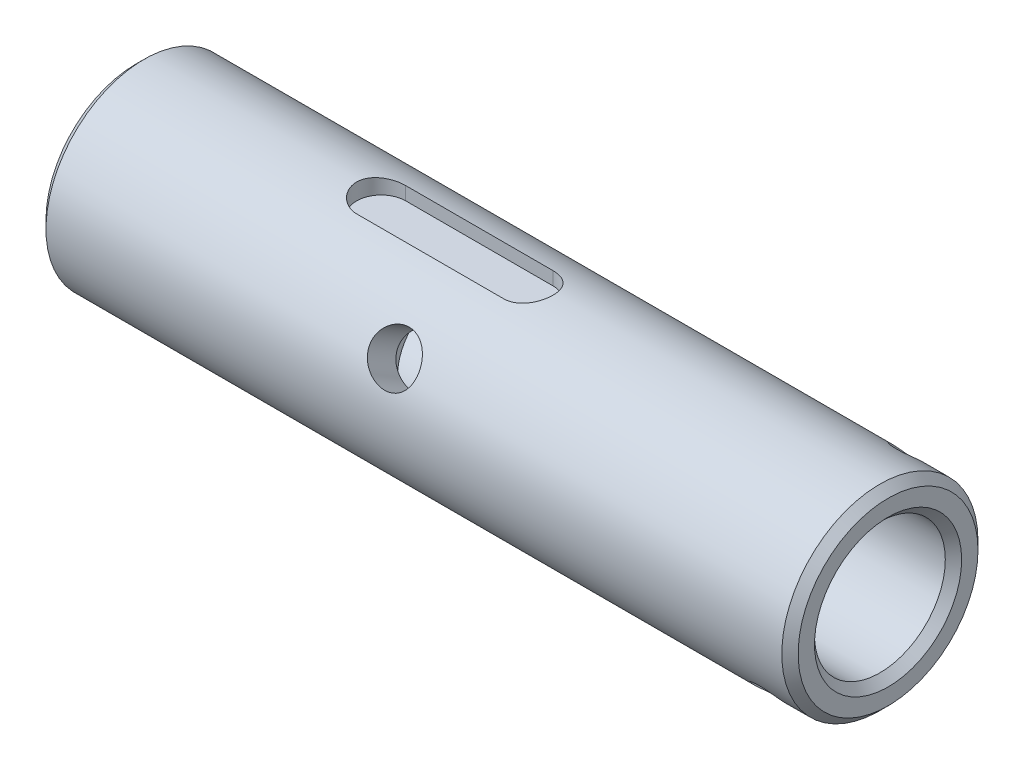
SolidWorks part; units mm, degrees
ref_plane "前视基准面" through (0, 0, 0) normal (0, 0, 1) x (1, 0, 0)
ref_plane "上视基准面" through (0, 0, 0) normal (0, 1, 0) x (1, 0, 0)
ref_plane "右视基准面" through (0, 0, 0) normal (1, 0, 0) x (0, 0, -1)
sketch "草图1" plane through (0, 0, 0) normal (1, 0, 0) x (0, 0, -1)
  circle A0 centre (0, 0) radius 12
  circle A1 centre (0, 0) radius 6
extrude "拉伸1" add sketch "草图1" along normal blind 92
sketch "草图2" plane through (0, 0, 0) normal (0, 1, 0) x (1, 0, 0)
  line L0 (0, 0) -> (40.9917, 0) construction
  line L1 (0, 3) -> (12, 3)
  line L2 (0, 12) -> (0, -12) construction
  line L3 (12, -3) -> (0, -3)
  line L4 (0, -3) -> (0, 3)
  arc A0 (12, 3) -> (12, -3) centre (12, 0) cw
extrude "切除-拉伸1" cut sketch "草图2" against normal through all
ref_plane "基准面1" through (0, 12, 0) normal (0, 1, 0) x (-1, 0, 0)
sketch "草图3" plane through (0, 12, 0) normal (0, 1, 0) x (-1, 0, 0)
  line L0 (-48, 3) -> (-30, 3)
  line L1 (-30, -3) -> (-48, -3)
  line L2 (0, 0) -> (-99.7989, 0) construction
  line L3 (0, -12) -> (0, 12) construction
  arc A0 (-30, 3) -> (-30, -3) centre (-30, 0) cw
  arc A1 (-48, -3) -> (-48, 3) centre (-48, 0) cw
  dimension "D3" = 3
  dimension "D1" = 30
  dimension "D2" = 18
extrude "切除-拉伸2" cut sketch "草图3" against normal blind 2
ref_plane "基准面2" through (0, -12, 0) normal (0, 1, 0) x (-1, 0, 0)
sketch "草图4" plane through (0, -12, 0) normal (0, 1, 0) x (-1, 0, 0)
  line L0 (0, -12) -> (0, 12) construction
  circle A0 centre (-42, 0) radius 3
  dimension "D1" = 42
extrude "切除-拉伸3" cut sketch "草图4" along normal up to next
ref_plane "基准面3" through (42, 0, 0) normal (-1, 0, 0) x (0, 0, 1)
sketch "草图5" plane through (42, 0, 0) normal (-1, 0, 0) x (0, 0, 1)
  line L0 (0, 0) -> (16.0641, 9.2746) construction
  line L1 (0, 0) -> (0, -13.8188) construction
  line L2 (4.128, 2.3833) -> (5.628, -0.2148)
  line L3 (5.628, -0.2148) -> (12.8001, 3.926)
  line L4 (12.8001, 3.926) -> (11.3001, 6.5241)
  line L5 (11.3001, 6.5241) -> (4.128, 2.3833)
  dimension "D1" = 120
revolve "切除-旋转1" cut sketch "草图5" angle 360 about L5
sketch "草图6" plane through (42, 0, 0) normal (-1, 0, 0) x (0, 0, 1)
  line L0 (0, 0) -> (0, -14.2482) construction
  line L1 (0, -14.2482) -> (0, 0) construction
  line L2 (0, 0) -> (-13.205, 7.6239) construction
  line L3 (-11.1922, 6.4618) -> (-12.6922, 3.8637)
  line L4 (-12.6922, 3.8637) -> (-5.0498, -0.5486)
  line L5 (-5.0498, -0.5486) -> (-3.5498, 2.0495)
  line L6 (-3.5498, 2.0495) -> (-11.1922, 6.4618)
  dimension "D1" = 120
revolve "切除-旋转2" cut sketch "草图6" angle 360 about L6
ref_plane "基准面4" through (86, 0, 0) normal (1, 0, 0) x (0, 0, -1)
sketch "草图7" plane through (86, 0, 0) normal (1, 0, 0) x (0, 0, -1)
  line L0 (0, 0) -> (11.3459, 11.3459) construction
  line L1 (9.4642, 9.4642) -> (10.8784, 8.05)
  line L2 (10.8784, 8.05) -> (-8.0747, -10.9031)
  line L3 (-8.0747, -10.9031) -> (-9.4889, -9.4889)
  line L4 (-9.4889, -9.4889) -> (9.4642, 9.4642)
revolve "切除-旋转3" cut sketch "草图7" angle 360 about L4
sketch "草图9" plane through (92, 0, 0) normal (1, 0, 0) x (0, 0, -1)
  circle A0 centre (0, 0) radius 8
extrude "切除-拉伸4" cut sketch "草图9" against normal blind 54
chamfer "倒角1" distance 1 angle 45 1 edges at (92, 0, -8)
chamfer "倒角2" distance 1 angle 45 1 edges at (92, 0, -12)
chamfer "倒角3" distance 1 angle 45 1 edges at (0, 12, 0)
